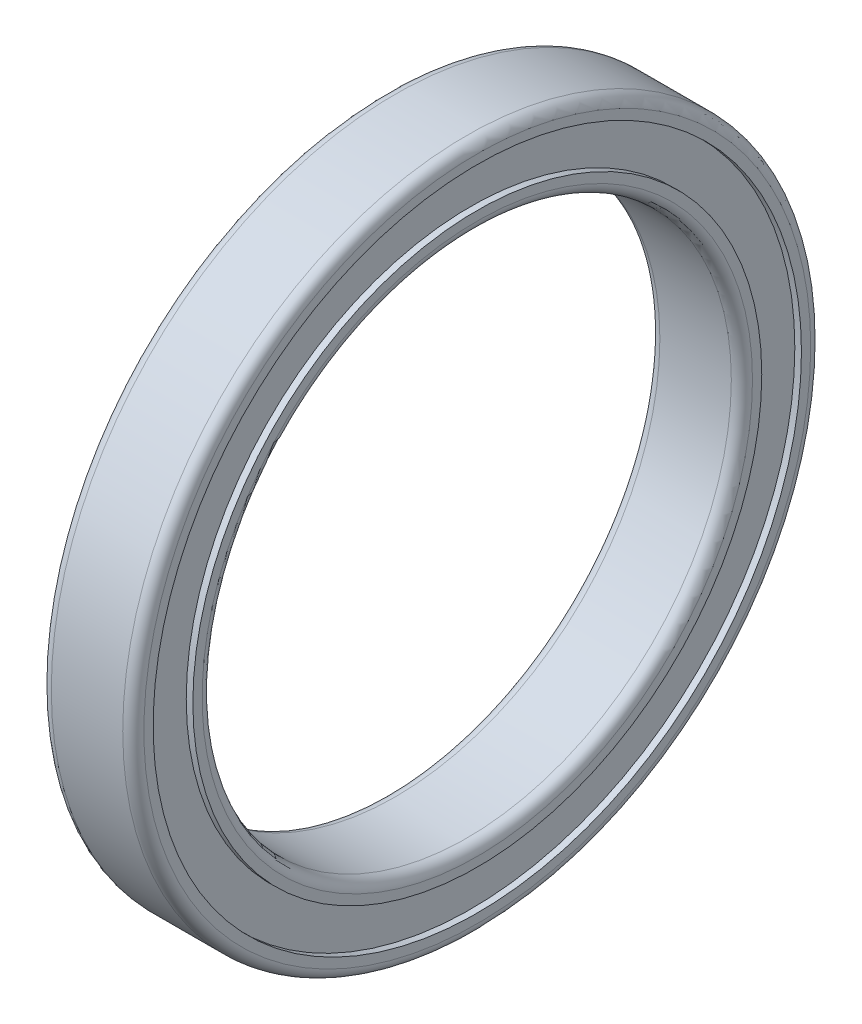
SolidWorks part; units mm, degrees
ref_plane "Спереди" through (0, 0, 0) normal (0, 0, 1) x (1, 0, 0)
ref_plane "Сверху" through (0, 0, 0) normal (0, 1, 0) x (1, 0, 0)
ref_plane "Справа" through (0, 0, 0) normal (1, 0, 0) x (0, 0, -1)
sketch "Эскиз1" plane through (0, 0, 0) normal (0, 0, 1) x (1, 0, 0)
  line L0 (0, 0) -> (-18.1184, 0) construction
  line L1 (0, 0) -> (0, 22.9845) construction
  line L2 (3.5, 20) -> (-3.5, 20)
  line L3 (-3.5, 20) -> (-3.5, 21.5)
  line L4 (-3, 21.5) -> (-3.5, 21.5)
  line L5 (-3, 21.5) -> (-3, 24.5)
  line L6 (-3, 24.5) -> (-3.5, 24.5)
  line L7 (-3.5, 24.5) -> (-3.5, 26)
  line L8 (-3.5, 26) -> (3.5, 26)
  line L9 (3.5, 24.5) -> (3.5, 26)
  line L10 (3, 24.5) -> (3.5, 24.5)
  line L11 (3, 21.5) -> (3, 24.5)
  line L12 (3, 21.5) -> (3.5, 21.5)
  line L13 (3.5, 20) -> (3.5, 21.5)
  point P13 (0, 26)
  point P18 (0, 20)
  dimension "D1" = 40
  dimension "D2" = 52
  dimension "D3" = 7
  dimension "D4" = 0.5
  dimension "D5" = 1.5
revolve "Повернуть1" add sketch "Эскиз1" angle 360 about L0
fillet "Скругление1" radius 0.8 4 edges at (3.5, 0, -26) (-3.5, 0, -26) (-3.5, 0, -20) (3.5, 0, -20)
